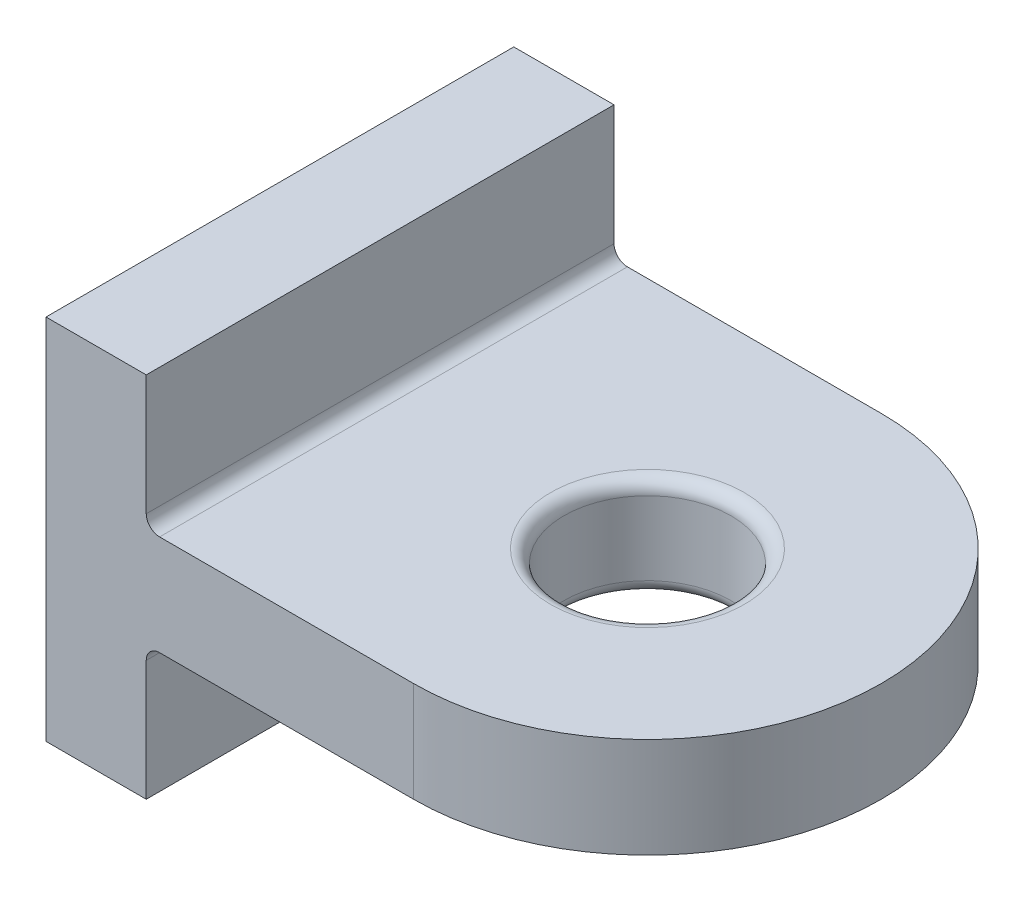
SolidWorks part; units mm, degrees
ref_plane "Front Plane" through (0, 0, 0) normal (0, 0, 1) x (1, 0, 0)
ref_plane "Top Plane" through (0, 0, 0) normal (0, 1, 0) x (1, 0, 0)
ref_plane "Right Plane" through (0, 0, 0) normal (1, 0, 0) x (0, 0, -1)
sketch "Sketch1" plane through (0, 0, 0) normal (1, 0, 0) x (0, 0, -1)
  line L1 (-44.45, 0) -> (44.45, 0)
  line L2 (-44.45, 0) -> (-44.45, -44.45)
  line L3 (-44.45, -44.45) -> (44.45, -44.45)
  line L4 (44.45, 0) -> (44.45, -44.45)
  dimension "D1" = 88.9
  dimension "D2" = 44.45
extrude "Extrude1" add sketch "Sketch1" along normal blind 19.05
sketch "Sketch2" plane through (0, 0, 0) normal (0, 1, 0) x (1, 0, 0)
  line L0 (19.05, 44.45) -> (69.85, 44.45)
  line L1 (69.85, -44.45) -> (19.05, -44.45)
  line L2 (19.05, -44.45) -> (19.05, 44.45)
  arc A0 (69.85, 44.45) -> (69.85, -44.45) centre (69.85, 0) cw
  dimension "D1" = 50.8
extrude "Extrude2" add sketch "Sketch2" against normal blind 19.05
sketch "Sketch3" plane through (0, 0, 0) normal (0, 1, 0) x (1, 0, 0)
  circle A0 centre (69.85, 0) radius 15.875
  dimension "D1" = 31.75
extrude "Cut-Extrude1" cut sketch "Sketch3" against normal through all
sketch "Sketch4" plane through (0, 0, 0) normal (-1, 0, 0) x (0, 0, 1)
  line L0 (44.45, 0) -> (44.45, -44.45) construction
  line L1 (-44.45, 0) -> (44.45, 0)
  line L2 (-44.45, 0) -> (-44.45, 25.4)
  line L3 (-44.45, 25.4) -> (44.45, 25.4)
  line L4 (44.45, 0) -> (44.45, 25.4)
  dimension "D1" = 25.4
extrude "Extrude3" add sketch "Sketch4" against normal up to surface (19.05 mm away)
fillet "Fillet1" radius 2.54 4 edges at (69.85, 0, 15.875) (69.85, -19.05, -15.875)
